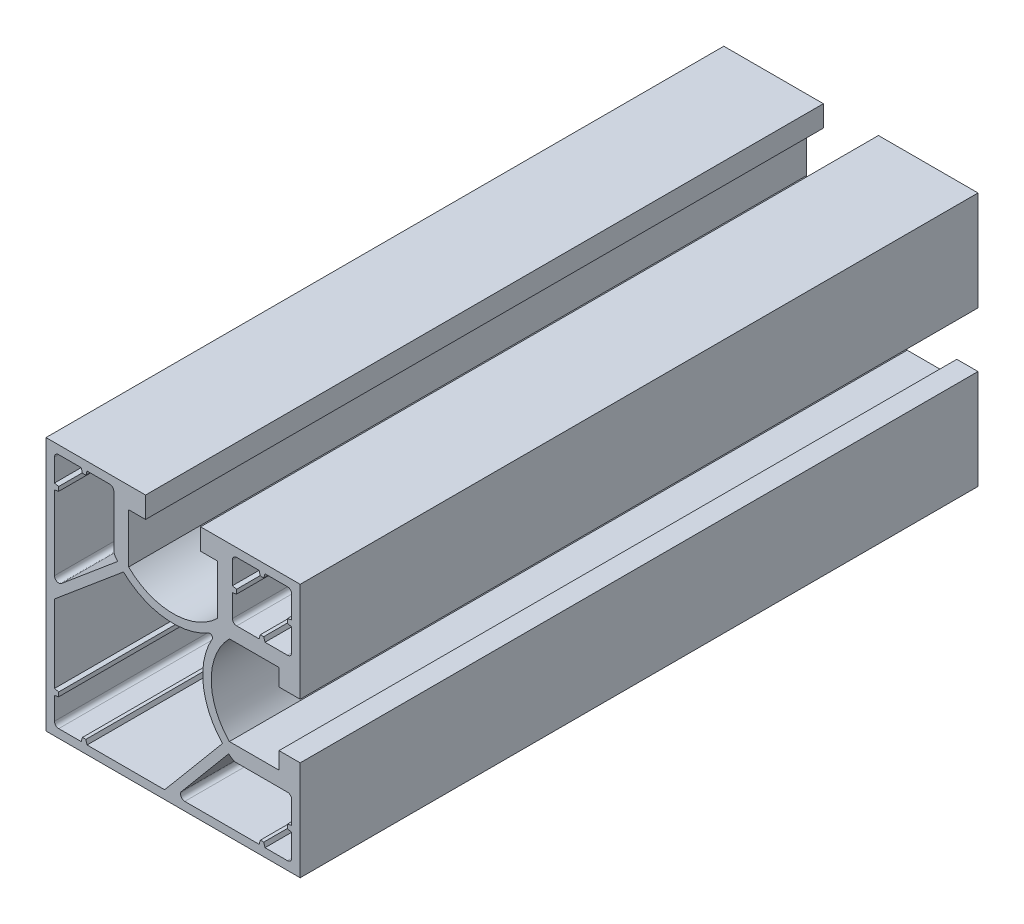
SolidWorks part; units mm, degrees
ref_plane "前基準面" through (0, 0, 0) normal (0, 0, 1) x (1, 0, 0)
ref_plane "上基準面" through (0, 0, 0) normal (0, 1, 0) x (1, 0, 0)
ref_plane "右基準面" through (0, 0, 0) normal (1, 0, 0) x (0, 0, -1)
sketch "草圖1" plane through (0, 0, 0) normal (0, 0, 1) x (1, 0, 0)
  line L0 (0, 18) -> (0, 0) construction
  line L1 (0, 0) -> (18, 0) construction
  line L2 (-7, 14) -> (-7, 7.5)
  line L3 (-15, 15) -> (-3.25, 15)
  line L4 (-15, 15) -> (-15, -15)
  line L5 (-15, -15) -> (15, -15)
  line L6 (15, -15) -> (15, -3.25)
  line L7 (12.5, -5.25) -> (6.6439, -5.25)
  line L8 (-3.25, 15) -> (-3.25, 12.5)
  line L9 (-3.25, 12.5) -> (-5.25, 12.5)
  line L10 (-5.25, 12.5) -> (-5.25, 6.6439)
  line L11 (15, -3.25) -> (12.5, -3.25)
  line L12 (12.5, -3.25) -> (12.5, -5.25)
  line L13 (5.25, 12.5) -> (5.25, 6.6439)
  line L14 (3.25, 12.5) -> (5.25, 12.5)
  line L15 (3.25, 15) -> (3.25, 12.5)
  line L16 (12.5, 3.25) -> (12.5, 5.25)
  line L17 (15, 3.25) -> (12.5, 3.25)
  line L18 (12.5, 5.25) -> (6.6439, 5.25)
  line L19 (3.25, 15) -> (15, 15)
  line L20 (15, 15) -> (15, 3.25)
  line L21 (7, 14) -> (10.15, 14)
  line L22 (7, 14) -> (7, 10.85)
  line L23 (7, 7) -> (10.15, 7)
  line L24 (14, 14) -> (14, 10.85)
  line L25 (7.5, -7) -> (14, -7)
  line L26 (14, -14) -> (14, -10.85)
  line L27 (-7, 14) -> (-10.15, 14)
  line L28 (10.5, 7) -> (10.5, 14.3713) construction
  line L29 (7, 10.5) -> (14.3713, 10.5) construction
  line L30 (10.15, 14) -> (10.3, 13.5)
  line L31 (10.3, 13.5) -> (10.7, 13.5)
  line L32 (14, 10.85) -> (13.5, 10.75)
  line L33 (13.5, 10.75) -> (13.5, 10.25)
  line L34 (10.85, 14) -> (14, 14)
  line L35 (10.85, 14) -> (10.7, 13.5)
  line L36 (14, 10.15) -> (14, 7)
  line L37 (14, 10.15) -> (13.5, 10.25)
  line L38 (7, 10.15) -> (7.5, 10.25)
  line L39 (7.5, 10.75) -> (7.5, 10.25)
  line L40 (7, 10.85) -> (7.5, 10.75)
  line L41 (10.85, 7) -> (10.7, 7.5)
  line L42 (10.3, 7.5) -> (10.7, 7.5)
  line L43 (10.15, 7) -> (10.3, 7.5)
  line L44 (7, 10.15) -> (7, 7)
  line L45 (10.85, 7) -> (14, 7)
  line L46 (-14, 10.15) -> (-13.5, 10.25)
  line L47 (-13.5, 10.75) -> (-13.5, 10.25)
  line L48 (-14, 10.85) -> (-13.5, 10.75)
  line L49 (-10.85, 14) -> (-10.7, 13.5)
  line L50 (-10.3, 13.5) -> (-10.7, 13.5)
  line L51 (-10.15, 14) -> (-10.3, 13.5)
  line L52 (14, -10.15) -> (13.5, -10.25)
  line L53 (14, -10.85) -> (13.5, -10.75)
  line L54 (10.85, -14) -> (10.7, -13.5)
  line L55 (13.5, -10.75) -> (13.5, -10.25)
  line L56 (10.3, -13.5) -> (10.7, -13.5)
  line L57 (10.15, -14) -> (10.3, -13.5)
  line L58 (-10.15, -14) -> (-10.3, -13.5)
  line L59 (-10.3, -13.5) -> (-10.7, -13.5)
  line L60 (-10.85, -14) -> (-10.7, -13.5)
  line L61 (-14, -10.85) -> (-13.5, -10.75)
  line L62 (-13.5, -10.75) -> (-13.5, -10.25)
  line L63 (-14, -10.15) -> (-13.5, -10.25)
  line L64 (-14, 14) -> (-14, 10.85)
  line L65 (-14, 10.15) -> (-14, 0.3054)
  line L66 (-10.15, -14) -> (-1, -14)
  line L67 (-14, -10.85) -> (-14, -14)
  line L68 (-14, -14) -> (-10.85, -14)
  line L69 (14, -10.15) -> (14, -7)
  line L70 (10.85, -14) -> (14, -14)
  line L71 (-10.85, 14) -> (-14, 14)
  line L72 (-14, -1) -> (-5.853, 5.8362)
  line L73 (0.3054, -14) -> (6.5674, -6.5373)
  line L74 (0, 0) -> (-14, -14) construction
  line L75 (-1, -14) -> (5.8362, -5.853)
  line L76 (-14, 0.3054) -> (-6.5373, 6.5674)
  line L77 (0.3054, -14) -> (10.15, -14)
  line L78 (-0.234, -14.6428) -> (6.6626, -6.4238) construction
  line L79 (-1, -14) -> (5.8965, -5.7811) construction
  line L80 (-14.6428, -0.234) -> (-6.4238, 6.6626) construction
  line L81 (-14, -1) -> (-14, -10.15)
  line L82 (-14, -1) -> (-5.7811, 5.8965) construction
  arc A0 (-5.25, 6.6439) -> (5.25, 6.6439) centre (0, 12) ccw
  arc A1 (6.6439, -5.25) -> (6.6439, 5.25) centre (12, 0) cw
  arc A3 (6.9, -6.8) -> (6.5674, -6.5373) centre (12, 0) cw
  arc A5 (-7, 7.5) -> (-6.8, 6.9) centre (-6, 7.5) ccw
  arc A6 (5.9298, -5.95) -> (5.9298, 5.95) centre (12, 0) cw construction
  arc A7 (4.2024, 4.6115) -> (4.6115, 4.2024) centre (4.3508, 4.3508) cw
  arc A8 (7.5, -7) -> (6.9, -6.8) centre (7.5, -6) cw
  arc A9 (5.8362, -5.853) -> (4.6115, 4.2024) centre (12, 0) cw
  arc A10 (-5.853, 5.8362) -> (4.2024, 4.6115) centre (0, 12) ccw
  arc A11 (-6.5373, 6.5674) -> (-6.8, 6.9) centre (0, 12) cw
  point P48 (10.5, 13.5)
  point P50 (13.5, 10.5)
  point P55 (7.5, 10.5)
  point P60 (10.5, 7.5)
  point P64 (-13.5, 10.5)
  point P69 (-10.5, 13.5)
  point P78 (13.5, -10.5)
  point P79 (10.5, -13.5)
  point P88 (-10.5, -13.5)
  point P89 (-13.5, -10.5)
  dimension "D8" = 7.5
  dimension "D12" = 0.5
  dimension "D14" = 1
  dimension "D15" = 7
  dimension "D21" = 0.5
  dimension "D22" = 8.5
  dimension "D24" = 1
  dimension "D26" = 1
  dimension "D27" = 1
  dimension "D25" = 0.3
  dimension "D1" = 18
  dimension "D2" = 30
  dimension "D3" = 3
  dimension "D4" = 30
  dimension "D5" = 6.5
  dimension "D6" = 15
  dimension "D7" = 10.5
  dimension "D9" = 10.5
  dimension "D10" = 6.5
  dimension "D11" = 2.5
  dimension "D13" = 1
  dimension "D18" = 0.7
  dimension "D23" = 1
  dimension "D28" = 1
  dimension "D16" = 0.2
  dimension "D17" = 0.35
  dimension "D19" = 0.25
  dimension "D20" = 7
  dimension "D29" = 50
  dimension "D30" = 14
  dimension "D31" = 14
extrude "填料-伸長1" add sketch "草圖1" along normal mid plane 80
fillet "圓角1" radius 0.5 7 edges at (14, -7, 0) (14, -14, 0) (0.3054, -14, 0) (-14, -14, 0) (-14, 0.3054, 0) (-7, 14, 0) (-14, 14, 0)
fillet "圓角2" radius 0.5 4 edges at (7, 7, 0) (14, 7, 0) (14, 14, 0) (7, 14, 0)
